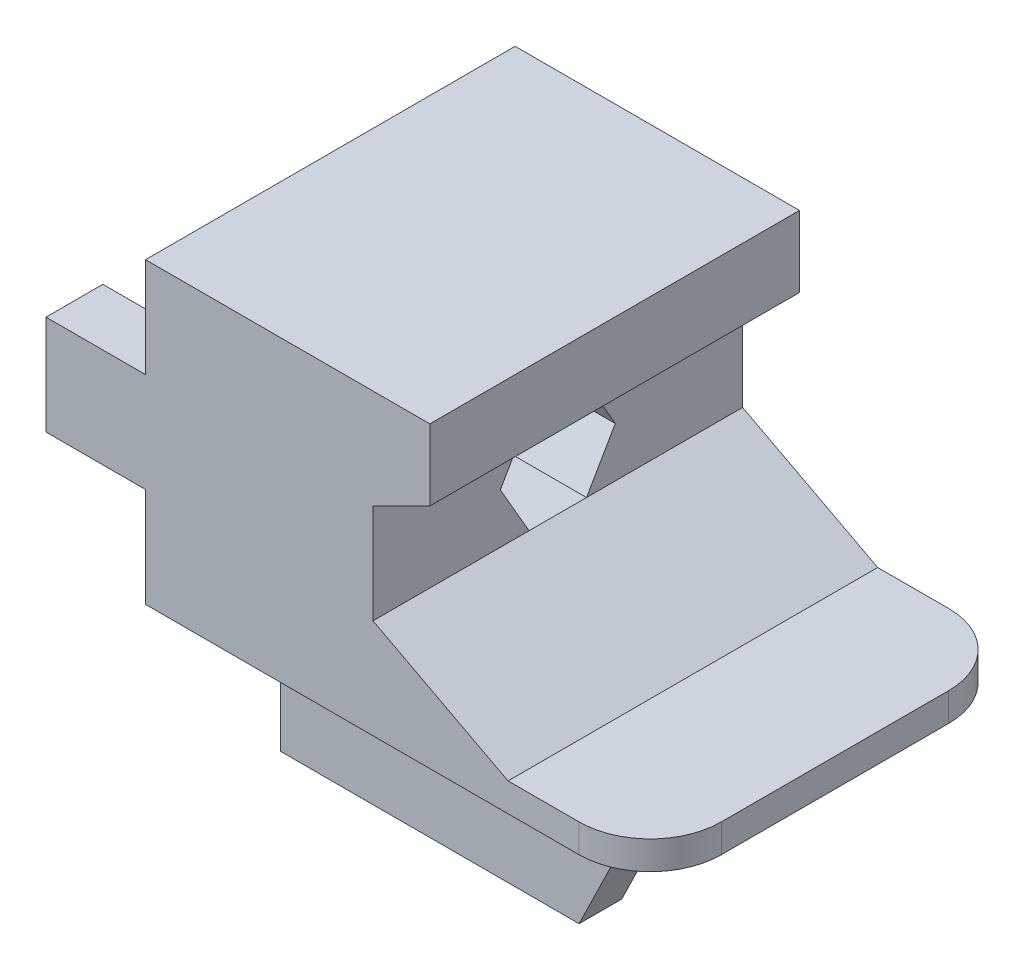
SolidWorks part; units mm, degrees
ref_plane "Plan de face" through (0, 0, 0) normal (0, 0, 1) x (1, 0, 0)
ref_plane "Plan de dessus" through (0, 0, 0) normal (0, 1, 0) x (1, 0, 0)
ref_plane "Plan de droite" through (0, 0, 0) normal (1, 0, 0) x (0, 0, -1)
sketch "Esquisse1" plane through (0, 0, 0) normal (0, 0, 1) x (1, 0, 0)
  line L0 (25.5, 2) -> (35.5, 2)
  line L1 (0, 0) -> (35.5, 0)
  line L2 (0, 0) -> (0, 21)
  line L3 (0, 21) -> (20, 21)
  line L4 (35.5, 0) -> (35.5, 2)
  line L5 (16, 14) -> (20, 16)
  line L6 (16, 14) -> (16, 7)
  line L7 (16, 7) -> (25.5, 2)
  line L8 (20, 16) -> (20, 21)
  dimension "D1" = 35.5
  dimension "D2" = 21
  dimension "D3" = 2
  dimension "D4" = 20
  dimension "D5" = 16
  dimension "D6" = 5
  dimension "D7" = 10
  dimension "D8" = 7
  dimension "D9" = 7
extrude "Boss.-Extru.1" add sketch "Esquisse1" along normal blind 26
sketch "Esquisse2" plane through (0, 0, 0) normal (0, -1, 0) x (1, 0, 0)
  line L0 (0, 26) -> (35.5, 26) construction
  line L1 (5.5, 22) -> (30.5, 22)
  line L2 (5.5, 22) -> (5.5, 19)
  line L3 (5.5, 19) -> (30.5, 19)
  line L4 (30.5, 22) -> (30.5, 19)
  line L5 (5.5, 7) -> (30.5, 7)
  line L6 (5.5, 7) -> (5.5, 4)
  line L7 (5.5, 4) -> (30.5, 4)
  line L8 (30.5, 7) -> (30.5, 4)
  line L9 (0, 0) -> (35.5, 0) construction
  line L10 (35.5, 26) -> (35.5, 0) construction
  point P12 (30.5, 20.5)
  dimension "D1" = 25
  dimension "D2" = 25
  dimension "D3" = 3
  dimension "D4" = 3
  dimension "D5" = 4
  dimension "D6" = 4
  dimension "D7" = 5
  dimension "D8" = 5
extrude "Boss.-Extru.2" add sketch "Esquisse2" along normal blind 8.2
sketch "Esquisse3" plane through (0, 0, 4) normal (0, 0, -1) x (-1, 0, 0)
  line L0 (-30.5, 0) -> (-26.5, -8.2)
  line L1 (-30.5, -8.2) -> (-30.5, 0) construction
  line L2 (-5.5, -8.2) -> (-30.5, -8.2) construction
  line L3 (-30.5, -8.2) -> (-30.5, 0)
  line L4 (-26.5, -8.2) -> (-30.5, -8.2)
  dimension "D1" = 4
extrude "Enlèv. mat.-Extru.1" cut sketch "Esquisse3" against normal through all
sketch "Esquisse4" plane through (0, 0, 0) normal (-1, 0, 0) x (0, 0, 1)
  line L0 (26, 0) -> (0, 0) construction
  line L1 (0, 14) -> (26, 14)
  line L3 (0, 7) -> (26, 7)
  line L7 (0, 21) -> (0, 0) construction
  line L8 (0, 14) -> (0, 7)
  line L9 (26, 21) -> (26, 0) construction
  line L10 (26, 14) -> (26, 7)
  dimension "D1" = 7
  dimension "D2" = 7
extrude "Boss.-Extru.3" add sketch "Esquisse4" along normal blind 7
sketch "Esquisse5" plane through (-7, 0, 0) normal (-1, 0, 0) x (0, 0, 1)
  line L0 (0, 21) -> (0, 14) construction
  line L1 (4, 18.0597) -> (22, 18.0597)
  line L2 (4, 18.0597) -> (4, 3.0597)
  line L3 (4, 3.0597) -> (22, 3.0597)
  line L4 (22, 18.0597) -> (22, 3.0597)
  dimension "D1" = 18
  dimension "D2" = 4
  dimension "D3" = 15
extrude "Enlèv. mat.-Extru.2" cut sketch "Esquisse5" against normal blind 5
sketch "Esquisse6" plane through (16, 0, 0) normal (1, 0, 0) x (0, 0, -1)
  line L0 (0, 7) -> (0, 14) construction
  line L1 (-26, 7) -> (0, 7) construction
  circle A0 centre (-13, 10.5) radius 2
  point P4 (0, 10.5)
  dimension "D1" = 13
  dimension "D2" = 3.5
extrude "Enlèv. mat.-Extru.3" cut sketch "Esquisse6" against normal through all
sketch "Esquisse7" plane through (16, 0, 0) normal (1, 0, 0) x (0, 0, -1)
  line L1 (-8.9585, 10.5) -> (-10.9793, 14)
  line L2 (-10.9793, 14) -> (-15.0207, 14)
  line L3 (-15.0207, 14) -> (-17.0415, 10.5)
  line L4 (-17.0415, 10.5) -> (-15.0207, 7)
  line L5 (-15.0207, 7) -> (-10.9793, 7)
  line L6 (-10.9793, 7) -> (-8.9585, 10.5)
  circle A0 centre (-13, 10.5) radius 3.5 construction
  point P1 (-13, 14)
  point P10 (-13, 7)
  dimension "D1" = 7
extrude "Enlèv. mat.-Extru.4" cut sketch "Esquisse7" against normal blind 7
fillet "Congé1" radius 5 2 edges at (35.5, 1, 0) (35.5, 1, 26)
